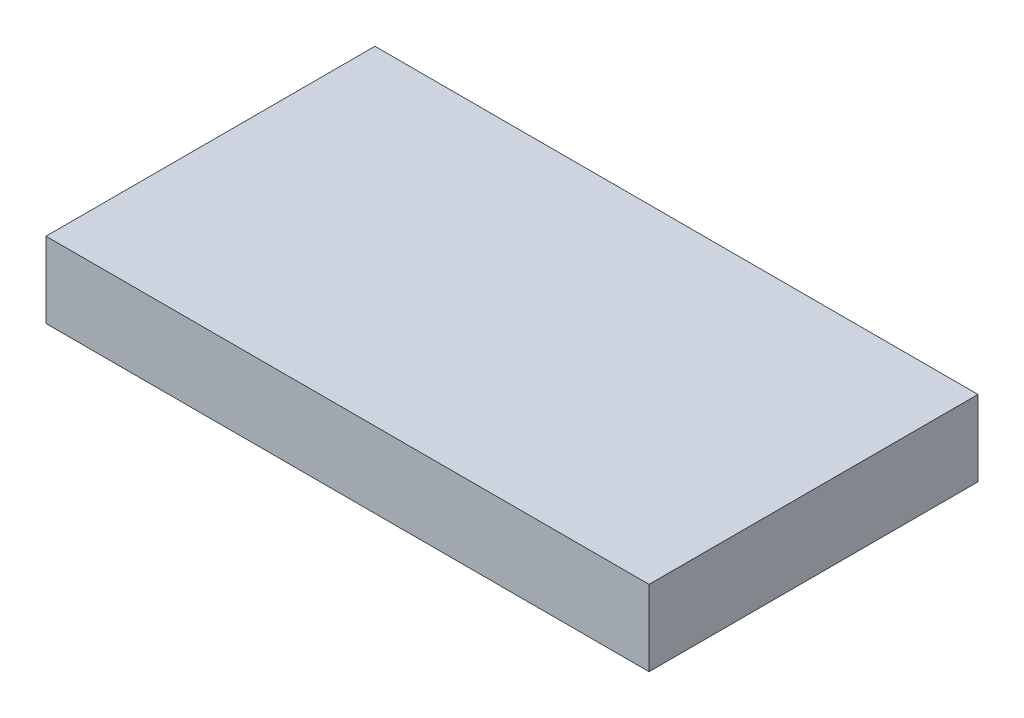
SolidWorks part; units mm, degrees
ref_plane "Front Plane" through (0, 0, 0) normal (0, 0, 1) x (1, 0, 0)
ref_plane "Top Plane" through (0, 0, 0) normal (0, 1, 0) x (1, 0, 0)
ref_plane "Right Plane" through (0, 0, 0) normal (1, 0, 0) x (0, 0, -1)
sketch "Sketch1" plane through (0, 0, 0) normal (0, 1, 0) x (1, 0, 0)
  line L1 (0, 0) -> (69.85, 0)
  line L2 (0, 0) -> (0, 38.1)
  line L3 (0, 38.1) -> (69.85, 38.1)
  line L4 (69.85, 0) -> (69.85, 38.1)
  dimension "D1" = 38.1
  dimension "D2" = 69.85
extrude "Boss-Extrude1" add sketch "Sketch1" along normal blind 8.763
